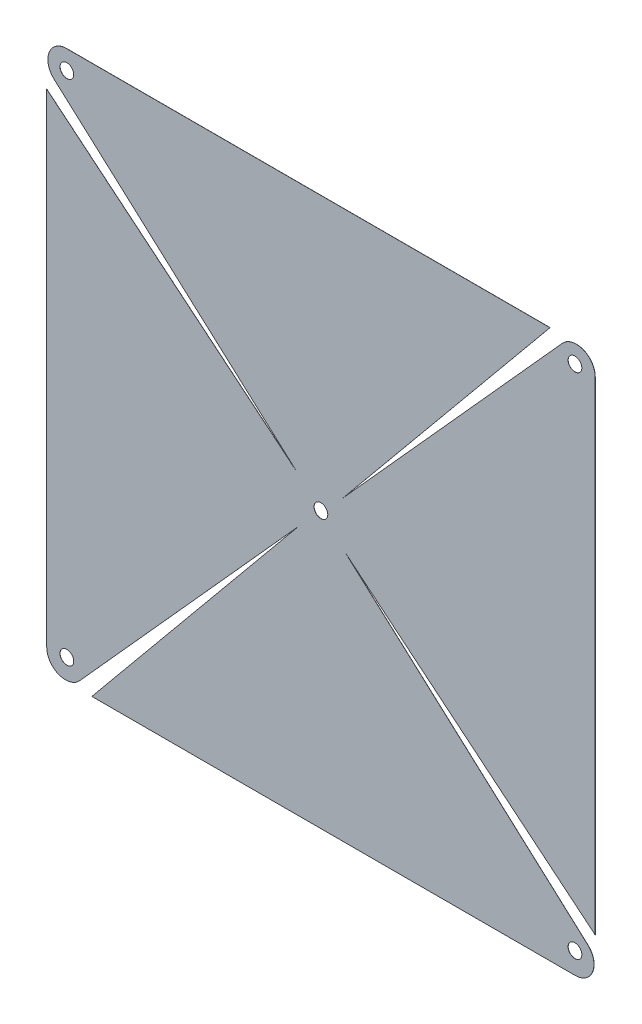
SolidWorks part; units mm, degrees
ref_plane "Front Plane" through (0, 0, 0) normal (0, 0, 1) x (1, 0, 0)
ref_plane "Top Plane" through (0, 0, 0) normal (0, 1, 0) x (1, 0, 0)
ref_plane "Right Plane" through (0, 0, 0) normal (1, 0, 0) x (0, 0, -1)
sketch "Sketch1" plane through (0, 0, 0) normal (0, 0, 1) x (1, 0, 0)
  line L0 (-1000, 0) -> (49000, 0) construction
  line L1 (0, -1000) -> (0, 49000) construction
  line L2 (0, 0) -> (32139.3805, 38302.2222) construction
  line L3 (0, 0) -> (-34313.9893, 30896.4547) construction
  line L4 (-4.719, 4.249) -> (-61.3466, 55.2367)
  line L5 (-61.3466, 55.2367) -> (46.3491, 55.2367)
  line L6 (0, 0) -> (35355.3391, 35355.3391) construction
  line L7 (4.4901, 4.4901) -> (46.3491, 55.2367)
  line L8 (4.4901, 4.4901) -> (55.4779, 61.1178)
  line L9 (55.4779, 61.1178) -> (55.4779, -46.578)
  line L10 (4.7313, -4.719) -> (55.4779, -46.578)
  line L11 (4.7313, -4.719) -> (61.3589, -55.7067)
  line L12 (61.3589, -55.7067) -> (-46.3368, -55.7067)
  line L13 (-4.4778, -4.9601) -> (-46.3368, -55.7067)
  line L14 (-4.4778, -4.9601) -> (-55.4656, -61.5878)
  line L15 (-55.4656, -61.5878) -> (-55.4656, 46.108)
  line L16 (-4.719, 4.249) -> (-55.4656, 46.108)
  circle A0 centre (0, 0) radius 1.3891
  circle A1 centre (0, 0) radius 6.35 construction
  circle A2 centre (51.3921, 51.3921) radius 1.3891
  circle A3 centre (51.3921, -51.3921) radius 1.3891
  circle A4 centre (-51.3921, -51.3921) radius 1.3891
  circle A5 centre (-51.3921, 51.3921) radius 1.3891
  point P18 (-4.719, 4.249)
  point P34 (0.0062, -0.235)
  point P39 (0, 0)
  dimension "D1" = 2.7781
  dimension "D2" = 12.7
  dimension "D3" = 48
  dimension "D4" = 40
  dimension "D5" = 45
  dimension "D6" = 76.2
  dimension "D7" = 4
  dimension "D10" = 4
extrude "Boss-Extrude1" add sketch "Sketch1" along normal blind 0.0254
fillet "Fillet1" radius 3.81 4 edges at (-61.3466, 55.2367, 0.0127) (-55.4656, -61.5878, 0.0127) (61.3589, -55.7067, 0.0127) (55.4779, 61.1178, 0.0127)
